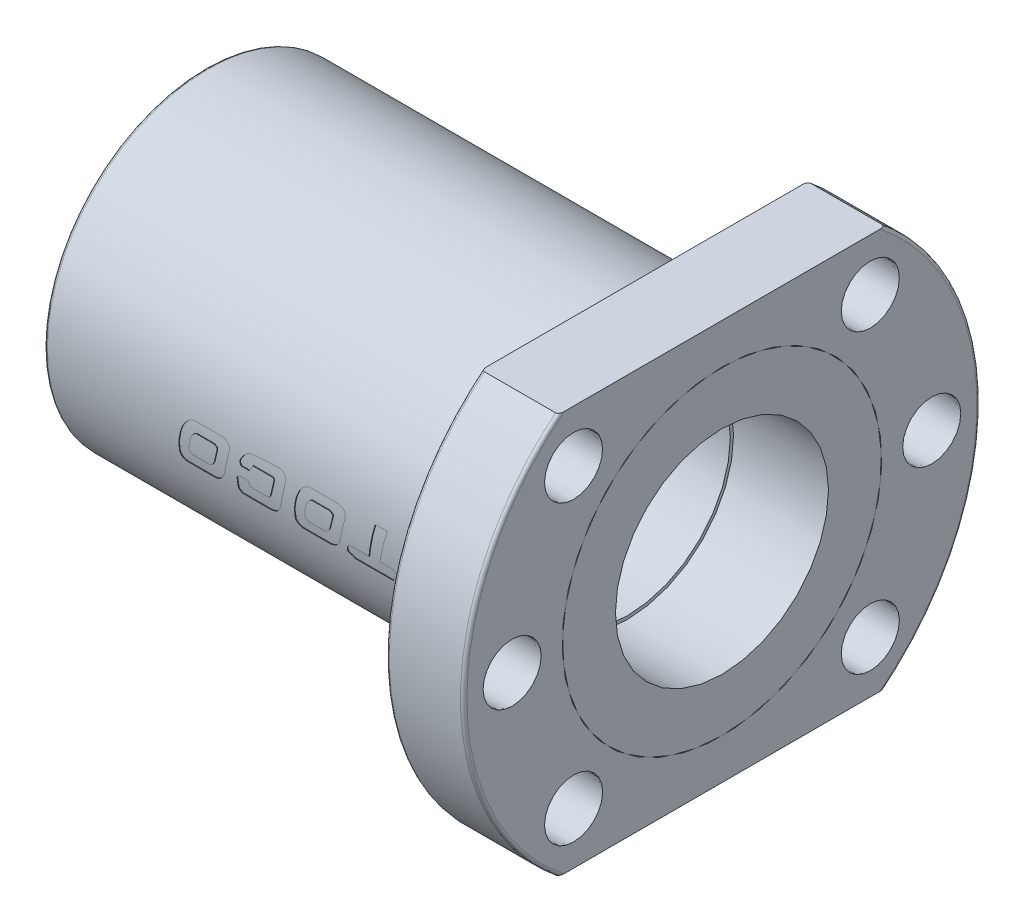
SolidWorks part; units mm, degrees
other "____1[1]"
ref_plane "Front Plane" through (0, 0, 0) normal (0, 0, 1) x (1, 0, 0)
ref_plane "Top Plane" through (0, 0, 0) normal (0, 1, 0) x (1, 0, 0)
ref_plane "Right Plane" through (0, 0, 0) normal (1, 0, 0) x (0, 0, -1)
imported_body "Imported1"
sketch "Sketch1" plane through (-120, 0, 0) normal (-1, 0, 0) x (0, 0, 1)
  circle A0 centre (0, 0) radius 16
extrude "Cut-Extrude1" cut sketch "Sketch1" against normal up to surface (120 mm away)
